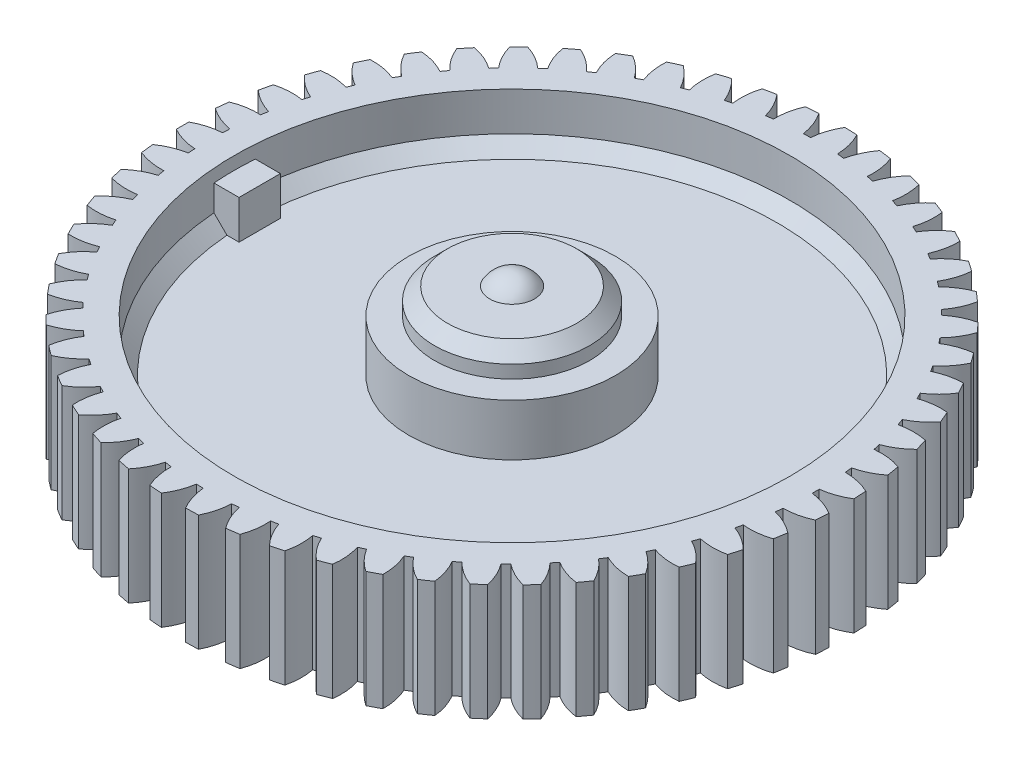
SolidWorks part; units mm, degrees
ref_plane "Plane1" through (0, 0, 0) normal (0, 0, 1) x (1, 0, 0)
ref_plane "Plane2" through (0, 0, 0) normal (0, 1, 0) x (1, 0, 0)
ref_plane "Plane3" through (0, 0, 0) normal (1, 0, 0) x (0, 0, -1)
sketch "Esquisse1" plane through (0, 0, 0) normal (0, 0, 1) x (1, 0, 0)
  line L0 (1.7321, 16) -> (5, 16)
  line L1 (4, 0) -> (4, 14)
  line L2 (4, 14) -> (0, 14)
  line L3 (21.5, 14) -> (21.5, 11)
  line L4 (6, 14) -> (6, 15)
  line L5 (6, 15) -> (5, 16)
  line L6 (6, 14) -> (8, 14)
  line L7 (8, 14) -> (8, 10)
  line L8 (21.5, 14) -> (25.5, 14)
  line L9 (25.5, 14) -> (25.5, 5)
  line L10 (25.5, 5) -> (8, 5)
  line L11 (8, 5) -> (8, 0)
  line L12 (8, 0) -> (4, 0)
  line L13 (21.5, 11) -> (20.5, 10)
  line L14 (20.5, 10) -> (8, 10)
  line L15 (0, 12.5) -> (0, 17.5) construction
  line L16 (0, 14) -> (0, 17)
  arc A1 (1.7321, 16) -> (0, 17) centre (0, 15) ccw
  dimension "D1" = 9
  dimension "D2" = 5
  dimension "D3" = 9
  dimension "D4" = 5
  dimension "D5" = 11
  dimension "D6" = 7.5
  dimension "D7" = 25.5
  dimension "D8" = 4
revolve "Base-Révolution" add sketch "Esquisse1" angle 360 about L15
sketch "Esquisse2" plane through (-2, 14, 0) normal (0, 1, 0) x (-1, 0, 0)
  line L0 (-3, 0) -> (-30.5, 0) construction
  arc A0 (-27.9734, 1.3189) -> (-27.9734, -1.3189) centre (-3, 0) ccw
  arc A1 (-25.4986, 0.269) -> (-25.4986, -0.269) centre (-3, 0) ccw
  arc A2 (-25.4986, 0.269) -> (-27.9734, 1.3189) centre (-24.9143, 5.0881) cw
  arc A4 (-25.4986, -0.269) -> (-27.9734, -1.3189) centre (-24.9143, -5.0881) ccw
extrude "Enlèv. mat.-Extru.1" cut sketch "Esquisse2" against normal through all
pattern_circular "Répétition circulaire1" count 55 every 6.545 about axis through (0, 12.5, 0) along (0, 1, 0)
sketch "Esquisse3" plane through (0, 10, 0) normal (0, 1, 0) x (-1, 0, 0)
  line L0 (19.5, 1.6263) -> (21.4384, 1.6263)
  line L1 (19.5, 1.6263) -> (19.5, -1.5737)
  line L2 (21.4423, -1.5737) -> (19.5, -1.5737)
  arc A0 (21.4423, -1.5737) -> (21.4384, 1.6263) centre (0, 0) ccw
extrude "Boss.-Extru.1" add sketch "Esquisse3" along normal blind 3
